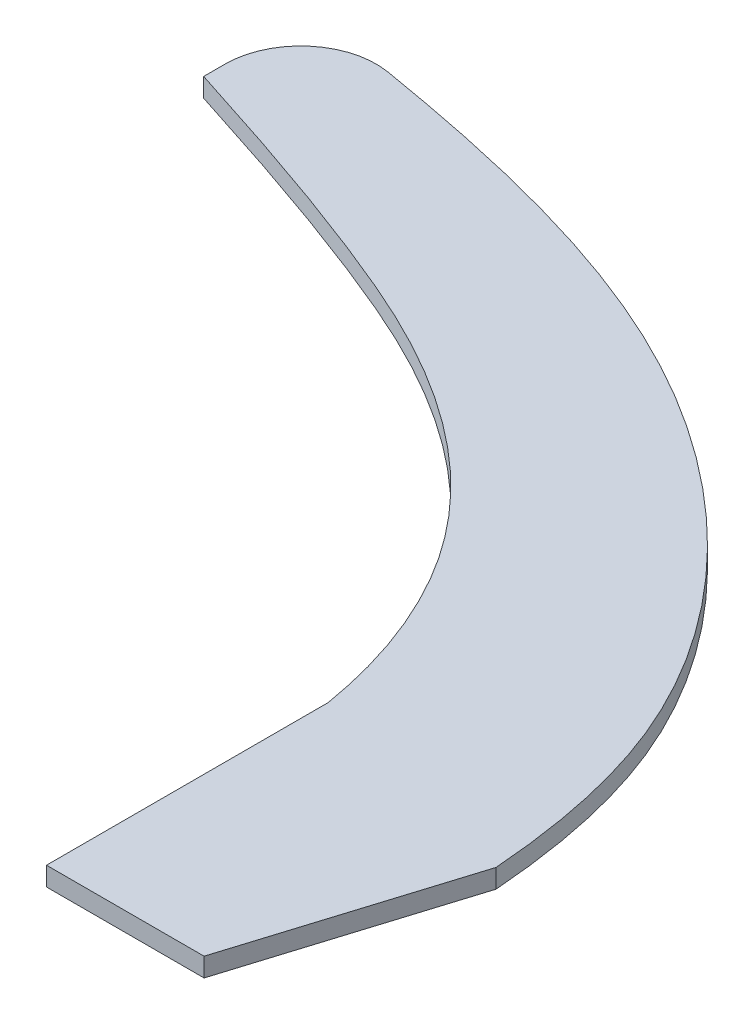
SolidWorks part; units mm, degrees
ref_plane "Front" through (0, 0, 0) normal (0, 0, 1) x (1, 0, 0)
ref_plane "Top" through (0, 0, 0) normal (0, 1, 0) x (1, 0, 0)
ref_plane "Right" through (0, 0, 0) normal (1, 0, 0) x (0, 0, -1)
sketch "Sketch1" plane through (0, 0, 0) normal (0, 1, 0) x (1, 0, 0)
  line L0 (-19.9053, 48.26) -> (-72.8802, 48.26)
  line L1 (-72.8802, 48.26) -> (-72.8802, 142.9772)
  line L3 (3.3198, 123.1825) -> (-19.9053, 48.26)
  line L5 (-276.0802, 304.3043) -> (-276.0802, 311.5256)
  arc A0 (-246.4526, 336.5714) -> (-276.0802, 311.5256) centre (-250.6802, 311.5256) ccw
  spline S2 degree 3 poles (3.3198, 123.1825) (1.73, 144.3509) (-10.6377, 212.5584) (-101.3084, 305.3992) (-196.449, 328.131) (-246.4526, 336.5714) knots 0.156421 0.156421 0.156421 0.156421 0.291932 0.595968 0.916312 0.916312 0.916312 0.916312
  spline S3 degree 3 poles (-72.8802, 142.9772) (-75.0895, 155.9848) (-80.1625, 174.0448) (-106.2174, 225.4242) (-147.7777, 255.8728) (-215.3131, 284.4979) (-249.397, 295.8167) (-276.0802, 304.3043) knots 0.204925 0.204925 0.204925 0.204925 0.291045 0.329597 0.561462 0.611079 0.796788 0.796788 0.796788 0.796788
  dimension "D2" = 25.4
extrude "Extrude1" add sketch "Sketch1" along normal blind 6.35
